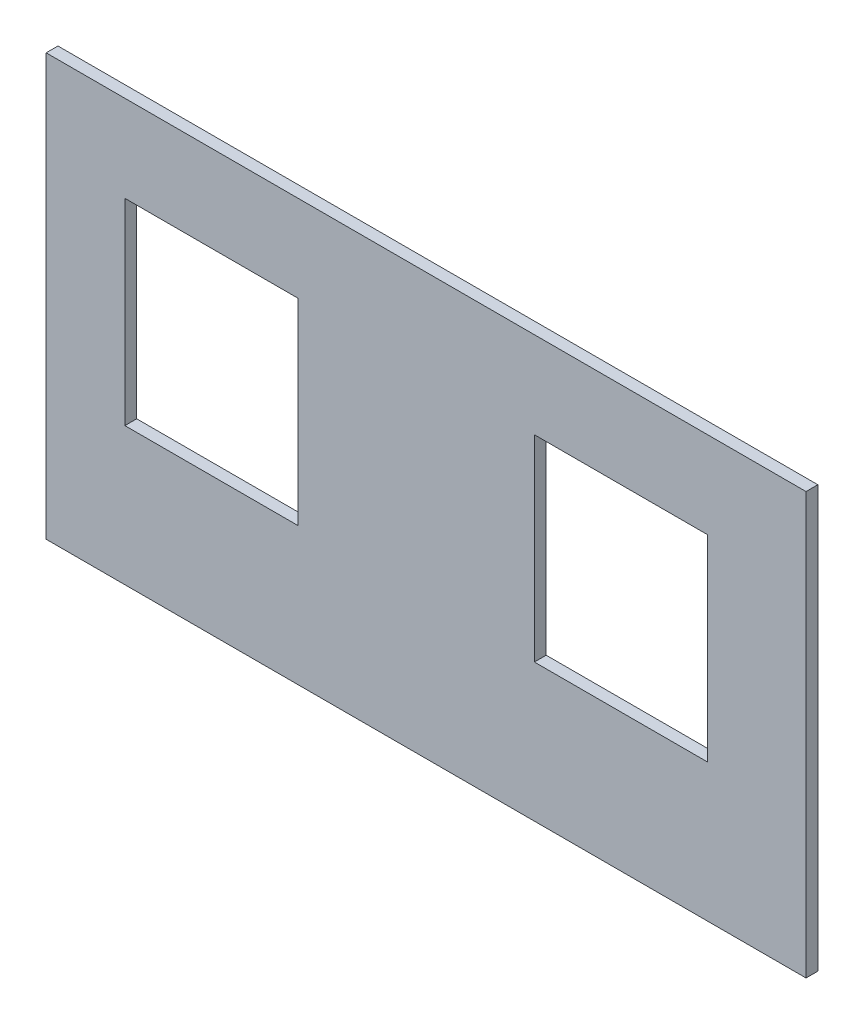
SolidWorks part; units mm, degrees
ref_plane "Plan de face" through (0, 0, 0) normal (0, 0, 1) x (1, 0, 0)
ref_plane "Plan de dessus" through (0, 0, 0) normal (0, 1, 0) x (1, 0, 0)
ref_plane "Plan de droite" through (0, 0, 0) normal (1, 0, 0) x (0, 0, -1)
sketch "Esquisse1" plane through (0, 0, 0) normal (0, 0, 1) x (1, 0, 0)
  line L1 (0, 0) -> (193, 0)
  line L2 (0, 0) -> (0, 107)
  line L3 (0, 107) -> (193, 107)
  line L4 (193, 0) -> (193, 107)
  dimension "D1" = 193
  dimension "D2" = 107
extrude "Extrusion1" add sketch "Esquisse1" along normal blind 3
sketch "Esquisse2" plane through (0, 0, 3) normal (0, 0, 1) x (1, 0, 0)
  line L0 (0, 0) -> (193, 0) construction
  line L1 (20, 35) -> (64, 35)
  line L2 (20, 35) -> (20, 85)
  line L3 (20, 85) -> (64, 85)
  line L4 (64, 35) -> (64, 85)
  line L5 (124, 35) -> (168, 35)
  line L6 (124, 35) -> (124, 85)
  line L7 (124, 85) -> (168, 85)
  line L8 (168, 35) -> (168, 85)
  line L9 (0, 107) -> (0, 0) construction
  line L10 (193, 0) -> (193, 107) construction
  dimension "D1" = 44
  dimension "D2" = 44
  dimension "D3" = 50
  dimension "D4" = 50
  dimension "D5" = 35
  dimension "D6" = 20
  dimension "D7" = 35
  dimension "D8" = 25
extrude "Enlèv. mat.-Extru.1" cut sketch "Esquisse2" against normal blind 3
